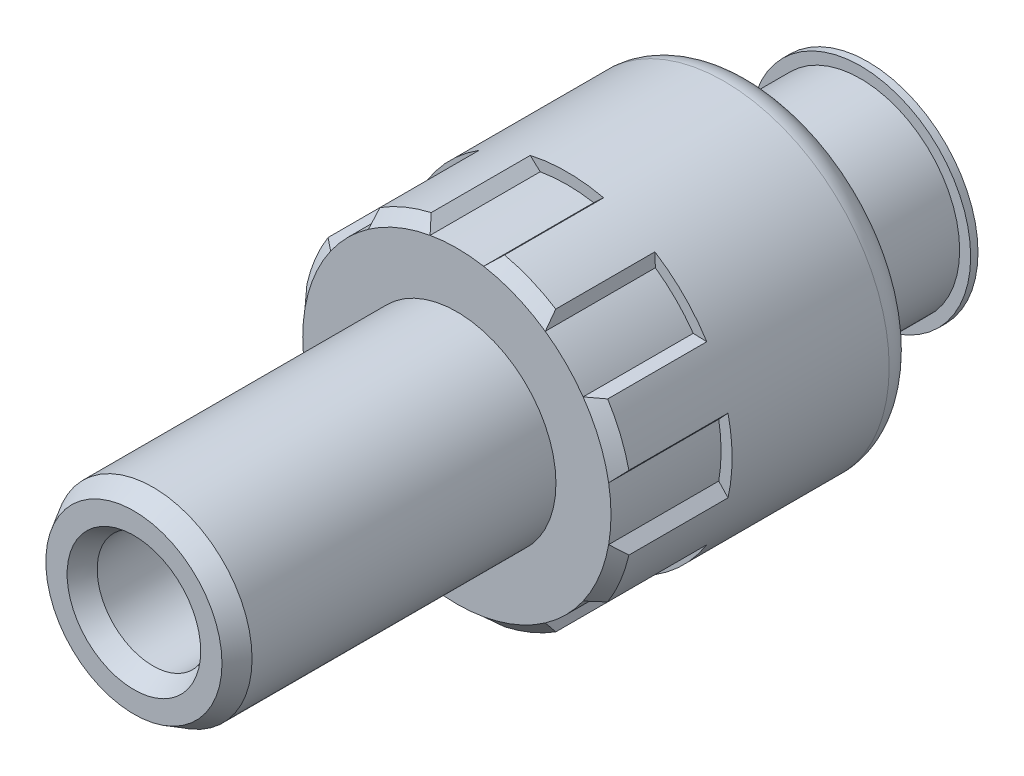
SolidWorks part; units mm, degrees
ref_plane "Front Plane" through (0, 0, 0) normal (0, 0, 1) x (1, 0, 0)
ref_plane "Top Plane" through (0, 0, 0) normal (0, 1, 0) x (1, 0, 0)
ref_plane "Right Plane" through (0, 0, 0) normal (1, 0, 0) x (0, 0, -1)
sketch "Sketch1" plane through (0, 0, 0) normal (1, 0, 0) x (0, 0, -1)
  line L0 (0, 0) -> (27.6676, 0) construction
  line L1 (0, 2.3114) -> (0, 3.048)
  line L2 (0.6599, 3.429) -> (11.176, 3.429)
  line L3 (0.6599, 1.9304) -> (17.4752, 1.9304)
  line L4 (25.4, 3.81) -> (25.4, 3.175)
  line L5 (11.176, 3.429) -> (11.176, 5.334)
  line L6 (11.557, 5.715) -> (20.4216, 5.715)
  line L7 (21.4376, 4.699) -> (21.4376, 3.81)
  line L8 (25.146, 3.81) -> (25.4, 3.81)
  line L9 (11.176, 5.334) -> (11.557, 5.715)
  line L10 (0, 3.048) -> (0.6599, 3.429)
  line L11 (0.6599, 1.9304) -> (0, 2.3114)
  line L12 (25.146, 3.81) -> (25.146, 3.429)
  line L13 (25.146, 3.429) -> (21.4376, 3.429)
  line L14 (21.4376, 3.429) -> (21.4376, 3.81)
  line L15 (25.4, 3.175) -> (17.4752, 3.175)
  line L16 (17.4752, 3.175) -> (17.4752, 1.9304)
  arc A0 (20.4216, 5.715) -> (21.4376, 4.699) centre (20.4216, 4.699) cw
  point P3 (0, 1.9304)
  point P4 (0, 3.429)
  point P10 (11.176, 5.715)
  dimension "D8" = 1.016
  dimension "D1" = 6.858
  dimension "D2" = 3.8608
  dimension "D3" = 25.4
  dimension "D4" = 11.176
  dimension "D5" = 11.43
  dimension "D6" = 3.9624
  dimension "D7" = 7.62
  dimension "D9" = 0.381
  dimension "D10" = 60
  dimension "D12" = 0.381
  dimension "D13" = 60
  dimension "D14" = 0.254
  dimension "D15" = 0.381
  dimension "D16" = 3.9624
  dimension "D17" = 6.35
revolve "body" add sketch "Sketch1" angle 360 about L0
sketch "Sketch2" plane through (0, 0, -11.176) normal (0, 0, 1) x (1, 0, 0)
  line L0 (0, 0) -> (0, 6.0491) construction
  line L1 (3.0595, 4.3694) -> (3.042, 4.8381)
  line L2 (4.3694, 3.0595) -> (4.8381, 3.042)
  line L3 (0.9924, 5.6282) -> (0, 0) construction
  line L4 (-0.9924, 5.6282) -> (0, 0) construction
  line L5 (-0.9262, 5.253) -> (-1.27, 5.5721)
  line L6 (0.9262, 5.253) -> (1.27, 5.5721)
  line L7 (5.253, 0.9262) -> (5.5721, 1.27)
  line L8 (5.253, -0.9262) -> (5.5721, -1.27)
  line L9 (4.3694, -3.0595) -> (4.8381, -3.042)
  line L10 (3.0595, -4.3694) -> (3.042, -4.8381)
  line L11 (0.9262, -5.253) -> (1.27, -5.5721)
  line L12 (-0.9262, -5.253) -> (-1.27, -5.5721)
  line L13 (-3.0595, -4.3694) -> (-3.042, -4.8381)
  line L14 (-4.3694, -3.0595) -> (-4.8381, -3.042)
  line L15 (-5.253, -0.9262) -> (-5.5721, -1.27)
  line L16 (-5.253, 0.9262) -> (-5.5721, 1.27)
  line L17 (-4.3694, 3.0595) -> (-4.8381, 3.042)
  line L18 (-3.0595, 4.3694) -> (-3.042, 4.8381)
  circle A0 centre (0, 0) radius 5.715 construction
  circle A1 centre (0, 0) radius 5.334 construction
  arc A2 (1.27, 5.5721) -> (-1.27, 5.5721) centre (0, 0) ccw
  arc A3 (0.9262, 5.253) -> (-0.9262, 5.253) centre (0, 0) ccw
  arc A4 (4.8381, 3.042) -> (3.042, 4.8381) centre (0, 0) ccw
  arc A5 (4.3694, 3.0595) -> (3.0595, 4.3694) centre (0, 0) ccw
  arc A6 (5.5721, -1.27) -> (5.5721, 1.27) centre (0, 0) ccw
  arc A7 (5.253, -0.9262) -> (5.253, 0.9262) centre (0, 0) ccw
  arc A8 (3.042, -4.8381) -> (4.8381, -3.042) centre (0, 0) ccw
  arc A9 (3.0595, -4.3694) -> (4.3694, -3.0595) centre (0, 0) ccw
  arc A10 (-1.27, -5.5721) -> (1.27, -5.5721) centre (0, 0) ccw
  arc A11 (-0.9262, -5.253) -> (0.9262, -5.253) centre (0, 0) ccw
  arc A12 (-4.8381, -3.042) -> (-3.042, -4.8381) centre (0, 0) ccw
  arc A13 (-4.3694, -3.0595) -> (-3.0595, -4.3694) centre (0, 0) ccw
  arc A14 (-5.5721, 1.27) -> (-5.5721, -1.27) centre (0, 0) ccw
  arc A15 (-5.253, 0.9262) -> (-5.253, -0.9262) centre (0, 0) ccw
  arc A16 (-3.042, 4.8381) -> (-4.8381, 3.042) centre (0, 0) ccw
  arc A17 (-3.0595, 4.3694) -> (-4.3694, 3.0595) centre (0, 0) ccw
  point P18 (0, 0)
  point P23 (0, 0)
  point P28 (0, 0)
  point P33 (0, 0)
  point P38 (0, 0)
  point P40 (0, 0)
  point P44 (0, 0)
  point P49 (0, 0)
  point P50 (0, 0)
  dimension "D1" = 10
  dimension "D2" = 20
  dimension "D3" = 1.27
  dimension "D4" = 1.27
extrude "flutes" cut sketch "Sketch2" against normal blind 3.81
sketch "Sketch3" plane through (0, 0, -17.4752) normal (0, 0, -1) x (-1, 0, 0)
  circle A2 centre (0, 0) radius 3.1067
  dimension "D1" = 6.2134
extrude "Boss-Extrude1" add sketch "Sketch3" along normal blind 7.62
